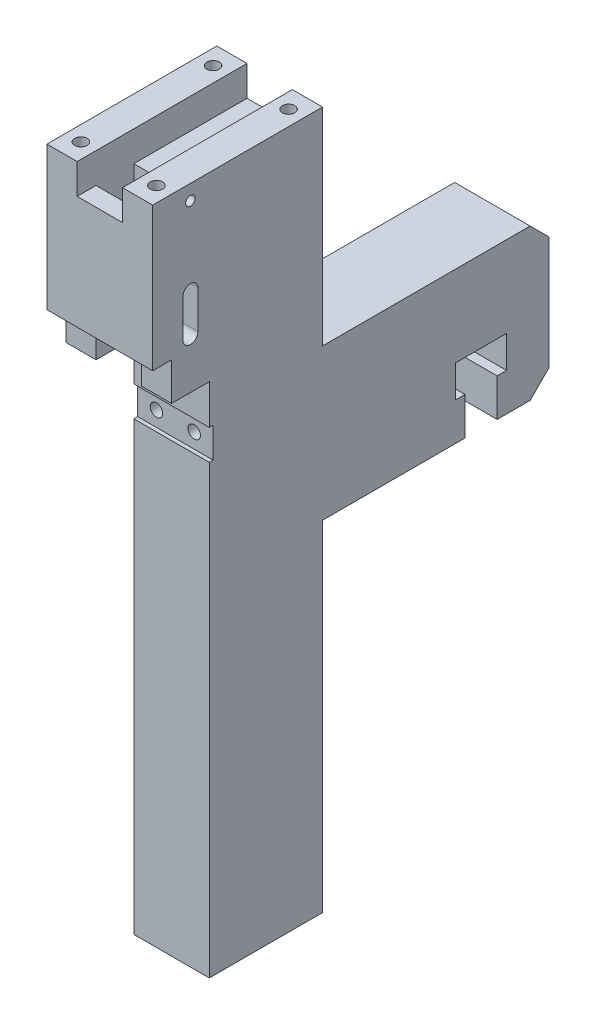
SolidWorks part; units mm, degrees
ref_plane "前视基准面" through (0, 0, 0) normal (0, 0, 1) x (1, 0, 0)
ref_plane "上视基准面" through (0, 0, 0) normal (0, 1, 0) x (1, 0, 0)
ref_plane "右视基准面" through (0, 0, 0) normal (1, 0, 0) x (0, 0, -1)
sketch "草图1" plane through (0, 0, 0) normal (0, 0, 1) x (1, 0, 0)
  line L0 (8, 0) -> (8, 136.8)
  line L1 (8, 0) -> (28, 0)
  line L2 (8, 176.8) -> (20, 176.8)
  line L3 (28, 0) -> (28, 184.8)
  line L4 (0, 136.8) -> (0, 184.8)
  line L5 (0, 136.8) -> (8, 136.8)
  line L6 (0, 184.8) -> (8, 184.8)
  line L7 (8, 176.8) -> (8, 184.8)
  line L8 (20, 176.8) -> (20, 184.8)
  line L9 (20, 184.8) -> (28, 184.8)
extrude "凸台-拉伸1" add sketch "草图1" along normal blind 105
sketch "草图2" plane through (28, 0, 0) normal (1, 0, 0) x (0, 0, -1)
  line L0 (-105, 146.8) -> (-100, 146.8)
  line L1 (-90, 0) -> (-90, 118.3)
  line L2 (-105, 146.8) -> (-105, 184.8)
  line L3 (-60, 0) -> (-60, 90)
  line L4 (-90, 0) -> (-60, 0)
  line L5 (-89, 118.3) -> (-89, 126.3)
  line L6 (-90, 126.3) -> (-89, 126.3)
  line L7 (-90, 118.3) -> (-89, 118.3)
  line L8 (-90, 126.3) -> (-90, 136.8)
  line L9 (-100, 136.8) -> (-90, 136.8)
  line L10 (-100, 146.8) -> (-100, 136.8)
  line L11 (-105, 184.8) -> (-60, 184.8)
  line L12 (-60, 90) -> (-22.25, 90)
  line L13 (-60, 130) -> (-5, 130)
  line L14 (0, 95) -> (0, 125)
  line L15 (-60, 130) -> (-60, 184.8)
  line L16 (-24.75, 100) -> (-22.25, 100)
  line L17 (-24.75, 108.5) -> (-11.25, 108.5)
  line L18 (-22.25, 100) -> (-22.25, 90)
  line L19 (-13.75, 100) -> (-13.75, 90)
  line L20 (-24.75, 108.5) -> (-24.75, 100)
  line L21 (-11.25, 108.5) -> (-11.25, 100)
  line L22 (-13.75, 100) -> (-11.25, 100)
  line L23 (-13.75, 90) -> (-5, 90)
  line L24 (-5, 130) -> (0, 125)
  line L25 (0, 95) -> (-5, 90)
extrude "切除-拉伸1" cut sketch "草图2" against normal blind 105 flip side to cut
sketch "草图3" plane through (28, 0, 0) normal (1, 0, 0) x (0, 0, -1)
  line L0 (-97, 149.8) -> (-97, 159.8)
  line L1 (-93, 149.8) -> (-93, 159.8)
  arc A0 (-97, 149.8) -> (-93, 149.8) centre (-95, 149.8) ccw
  arc A1 (-93, 159.8) -> (-97, 159.8) centre (-95, 159.8) ccw
extrude "切除-拉伸2" cut sketch "草图3" against normal blind 14
sketch "草图4" plane through (28, 0, 0) normal (1, 0, 0) x (0, 0, -1)
  circle A0 centre (-95, 180.8) radius 1.25
extrude "切除-拉伸3" cut sketch "草图4" against normal blind 14
sketch "草图8" plane through (0, 0, 89) normal (0, 0, 1) x (1, 0, 0)
  circle A0 centre (13, 122.3) radius 1.65
  circle A1 centre (23, 122.3) radius 1.65
extrude "切除-拉伸8" cut sketch "草图8" against normal blind 15
sketch "草图9" plane through (0, 184.8, 0) normal (0, 1, 0) x (1, 0, 0)
  circle A0 centre (4, -65) radius 1.65
  circle A1 centre (24, -65) radius 1.65
  circle A2 centre (24, -100) radius 1.65
  circle A3 centre (4, -100) radius 1.65
extrude "切除-拉伸9" cut sketch "草图9" against normal blind 15
sketch "草图10" plane through (0, 0, 105) normal (0, 0, 1) x (1, 0, 0)
  circle A0 centre (5, 156.3) radius 2.1
  circle A1 centre (23, 156.3) radius 2.1
sketch "草图11" plane through (0, 0, 60) normal (0, 0, -1) x (-1, 0, 0)
  circle A0 centre (-23, 156.3) radius 2.1
  circle A1 centre (-5, 156.3) radius 2.1
extrude "切除-拉伸10" cut sketch "草图11" against normal blind 15
sketch "草图13" plane through (0, 176.8, 0) normal (0, 1, 0) x (1, 0, 0)
  line L0 (8, -100) -> (8, -90)
  line L1 (20, -100) -> (20, -90)
  line L2 (8, -90) -> (20, -90)
  line L3 (8, -100) -> (20, -100)
extrude "切除-拉伸11" cut sketch "草图13" against normal through all
